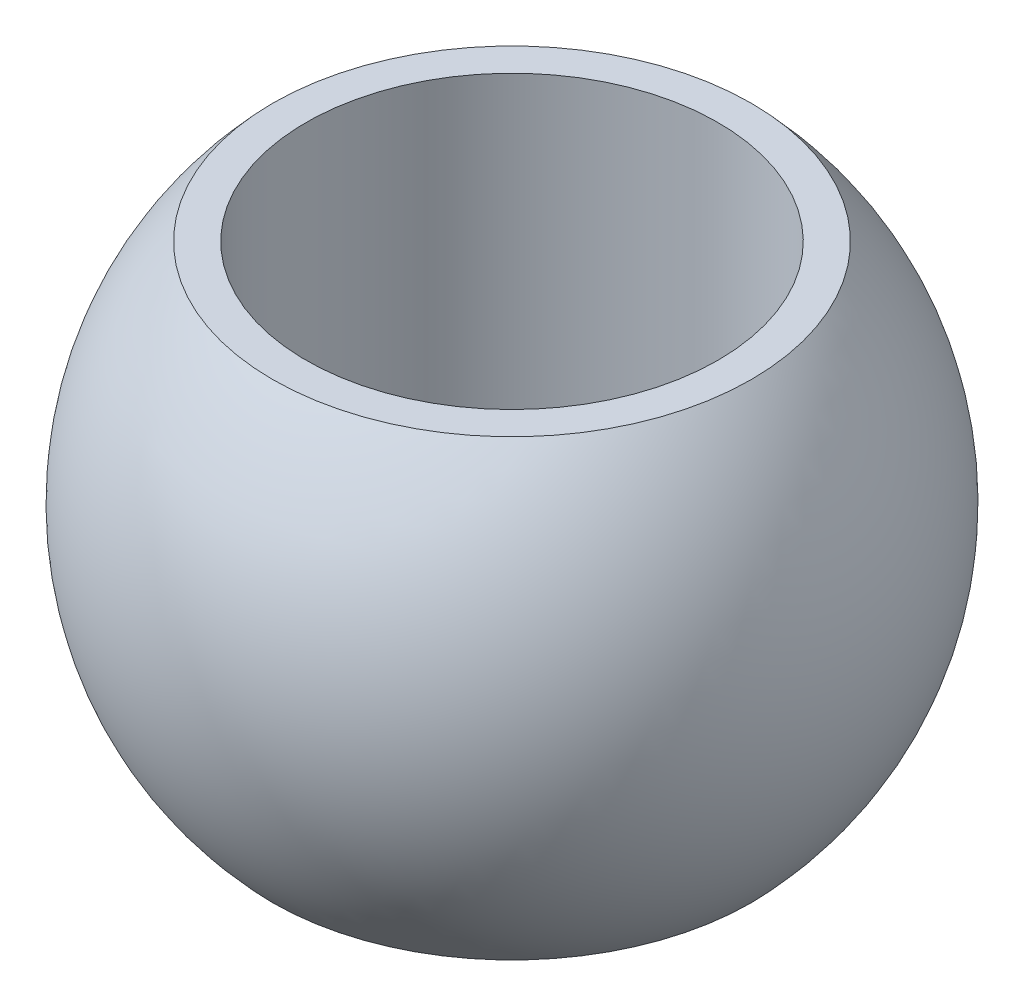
SolidWorks part; units mm, degrees
ref_plane "Front Plane" through (0, 0, 0) normal (0, 0, 1) x (1, 0, 0)
ref_plane "Top Plane" through (0, 0, 0) normal (0, 1, 0) x (1, 0, 0)
ref_plane "Right Plane" through (0, 0, 0) normal (1, 0, 0) x (0, 0, -1)
sketch "Sketch1" plane through (0, 0, 0) normal (0, 0, 1) x (1, 0, 0)
  line L0 (0, -27.5) -> (0, 27.5) construction
  line L1 (0, 27.5) -> (-25, 27.5) construction
  line L2 (-25, 27.5) -> (-25, -27.5)
  line L3 (-25, -27.5) -> (-29.0474, -27.5)
  line L4 (-25, 27.5) -> (-29.0474, 27.5)
  arc A0 (-29.0474, 27.5) -> (-29.0474, -27.5) centre (0, 0) ccw
  point P4 (0, 0)
  point P10 (0, 0)
  point P11 (0, 0)
  dimension "D3" = 40
  dimension "D1" = 25
  dimension "D2" = 55
revolve "Revolve1" add sketch "Sketch1" angle 360 about L0
